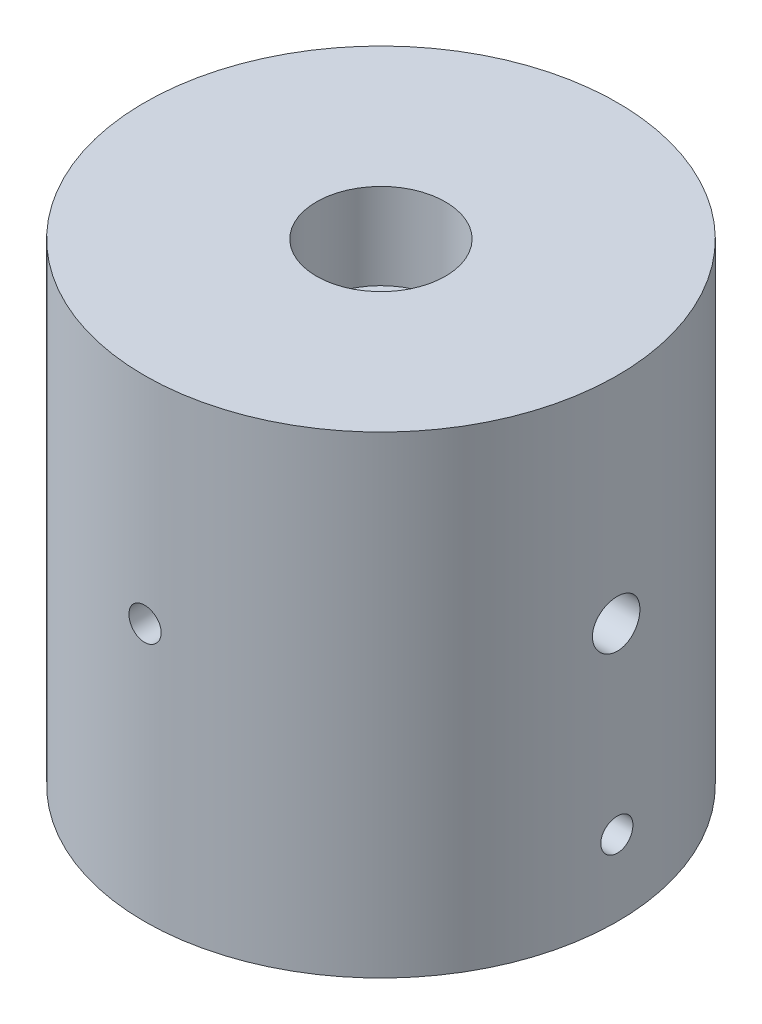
SolidWorks part; units mm, degrees
ref_plane "Front" through (0, 0, 0) normal (0, 0, 1) x (1, 0, 0)
ref_plane "Top" through (0, 0, 0) normal (0, 1, 0) x (1, 0, 0)
ref_plane "Right" through (0, 0, 0) normal (1, 0, 0) x (0, 0, -1)
sketch "Sketch1" plane through (0, 0, 0) normal (0, 1, 0) x (1, 0, 0)
  circle A0 centre (0, 0) radius 17.4625
  circle A1 centre (0, 0) radius 3.175
  dimension "D1" = 34.925
  dimension "D2" = 6.35
extrude "Extrude1" add sketch "Sketch1" along normal blind 34.925
ref_plane "Plane1" through (17.526, 0, 0) normal (1, 0, 0) x (0, 0, -1)
hole_wizard "3/32 (0.09375) Diameter Hole3" positions "Sketch5" profile "Sketch4" hole size "3/32" standard "Ansi Inch"
sketch "Sketch5" plane through (17.526, 0, 0) normal (1, 0, 0) x (0, 0, -1)
  point P1 (0, 5.5626)
sketch "Sketch4" plane through (17.526, 5.5626, 0) normal (0, 1, 0) x (0, 0, -1)
  line L0 (0, 0) -> (0, 34.9885)
  line L1 (0, 34.9885) -> (1.1874, 34.9885)
  line L2 (1.1874, 34.9885) -> (1.1874, 0)
  line L5 (1.1874, 0) -> (0, 0)
  line L11 (0, -6.35) -> (0, 107.95) construction
  dimension "Thru Hole Dia." = 2.3749
  dimension "Thru Hole Depth" = 34.9885
hole_wizard "#6-32 Tapped Hole1" positions "Sketch7" profile "Sketch6" tap size "#6-32" standard "Ansi Inch"
sketch "Sketch7" plane through (17.526, 0, 0) normal (1, 0, 0) x (0, 0, -1)
  line L0 (-17.4625, 0) -> (17.4625, 0) construction
  point P0 (0, 19.05)
  dimension "D1" = 19.05
sketch "Sketch6" plane through (17.526, 19.05, 0) normal (0, 1, 0) x (0, 0, -1)
  line L0 (0, 0) -> (0, 16.6877)
  line L1 (0, 16.6877) -> (1.3525, 15.875)
  line L2 (1.3525, 15.875) -> (1.3525, 7.9375)
  line L3 (1.3525, 7.9375) -> (1.7526, 7.9375)
  line L4 (1.7526, 7.9375) -> (1.7526, 0)
  line L5 (1.7526, 0) -> (0, 0)
  line L10 (0, 16.6877) -> (-1.3526, 15.875) construction
  line L11 (0, -6.35) -> (0, 107.95) construction
  dimension "Tap Drill Dia." = 2.7051
  dimension "Tap Drill Depth" = 15.875
  dimension "Thread Major Dia." = 3.5052
  dimension "Thread Depth" = 7.9375
  dimension "Drill Angle" = 118
pattern_circular "CirPattern1" count 2 over 360 about axis through (0, 34.925, 0) along (0, -1, 0) of "#6-32 Tapped Hole1"
sketch "Sketch8" plane through (0, 0, 0) normal (0, 0, 1) x (1, 0, 0)
  line L0 (0, 34.925) -> (0, 0) construction
  line L1 (-9.5885, 19.05) -> (-17.3743, 19.05) construction
  line L2 (2.8725, 19.05) -> (9.5885, 19.05) construction
  circle A0 centre (0, 19.05) radius 1.19
  dimension "D1" = 2.38
extrude "Cut-Extrude1" cut sketch "Sketch8" against normal through all and the other way through all
hole_wizard "3/8-32 Tapped Hole1" positions "Sketch10" profile "Sketch9" tap size "3/8-24" standard "Ansi Inch"
sketch "Sketch10" plane through (0, 34.925, 0) normal (0, 1, 0) x (-1, 0, 0)
  point P0 (0, 0)
sketch "Sketch9" plane through (0, 34.925, 0) normal (1, 0, 0) x (0, 0, 1)
  line L0 (0, 0) -> (0, 14.1794)
  line L1 (0, 14.1794) -> (4.2164, 11.6459)
  line L2 (4.2164, 11.6459) -> (4.2164, 6.35)
  line L3 (4.2164, 6.35) -> (4.7625, 6.35)
  line L4 (4.7625, 6.35) -> (4.7625, 0)
  line L5 (4.7625, 0) -> (0, 0)
  line L10 (0, 14.1794) -> (-4.2164, 11.6459) construction
  line L11 (0, -6.35) -> (0, 107.95) construction
  dimension "Tap Drill Dia." = 8.4328
  dimension "Tap Drill Depth" = 11.6459
  dimension "Thread Major Dia." = 9.525
  dimension "Thread Depth" = 6.35
  dimension "Drill Angle" = 118
